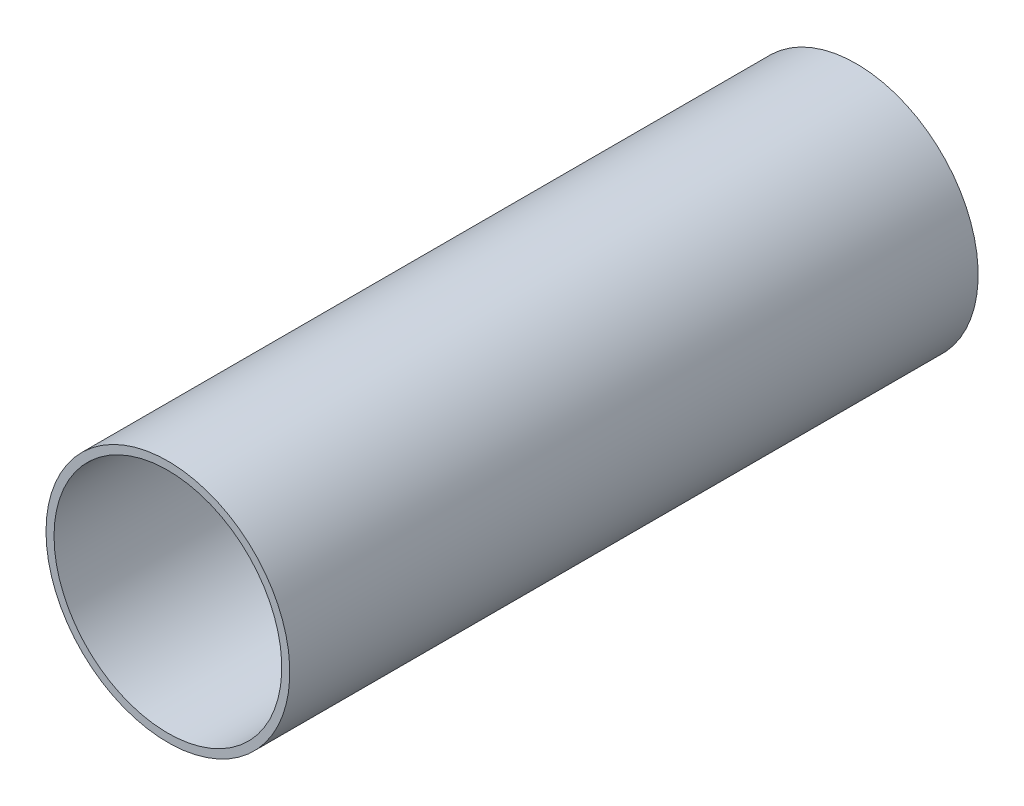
SolidWorks part; units mm, degrees
ref_plane "Front" through (0, 0, 0) normal (0, 0, 1) x (1, 0, 0)
ref_plane "Top" through (0, 0, 0) normal (0, 1, 0) x (1, 0, 0)
ref_plane "Right" through (0, 0, 0) normal (1, 0, 0) x (0, 0, -1)
sketch "Sketch1" plane through (0, 0, 0) normal (0, 0, 1) x (1, 0, 0)
  circle A0 centre (0, 0) radius 26.9875
  circle A1 centre (0, 0) radius 25.2095
  dimension "D1" = 53.975
  dimension "D2" = 50.419
extrude "Boss-Extrude1" add sketch "Sketch1" along normal blind 152.4
